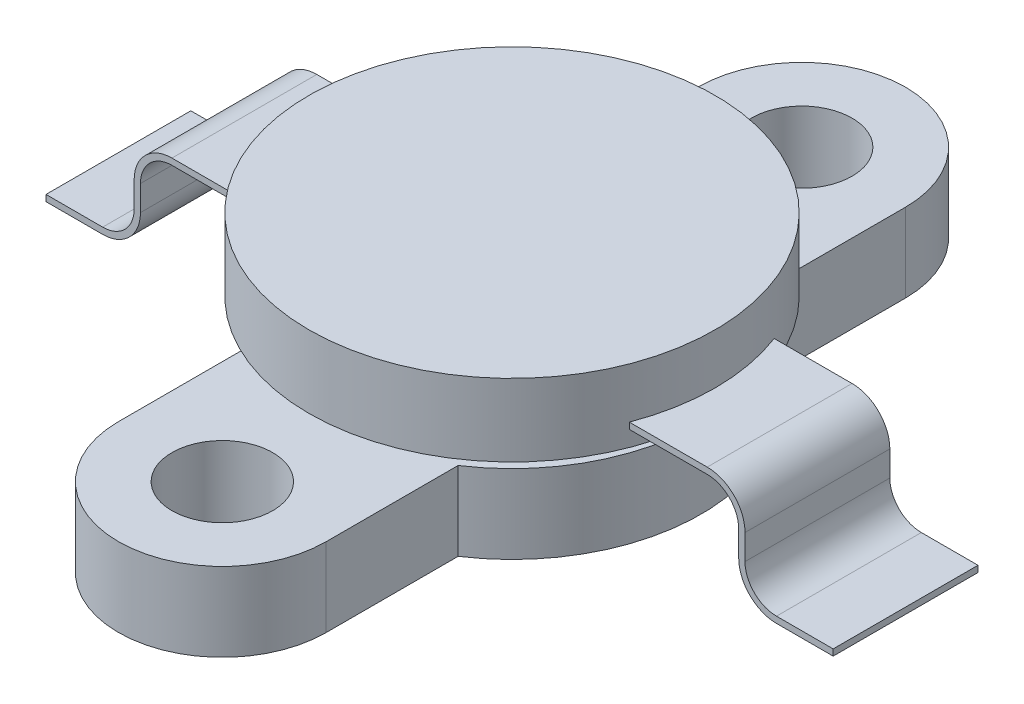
SolidWorks part; units mm, degrees
ref_plane "Front" through (0, 0, 0) normal (0, 0, 1) x (1, 0, 0)
ref_plane "Top" through (0, 0, 0) normal (0, 1, 0) x (1, 0, 0)
ref_plane "Right" through (0, 0, 0) normal (1, 0, 0) x (0, 0, -1)
sketch "Эскиз1" plane through (0, 0, 0) normal (0, 1, 0) x (1, 0, 0)
  line L0 (-3.3, 9.2) -> (-3.3, 5.011)
  line L1 (3.3, 9.2) -> (3.3, 5.011)
  line L2 (0, 0) -> (0, 9.2) construction
  line L3 (0, 0) -> (6, 0) construction
  line L4 (3.3, -9.2) -> (3.3, -5.011)
  line L5 (-3.3, -9.2) -> (-3.3, -5.011)
  arc A0 (-3.3, 5.011) -> (-3.3, -5.011) centre (0, 0) ccw
  arc A1 (3.3, 9.2) -> (-3.3, 9.2) centre (0, 9.2) ccw
  arc A2 (3.3, -9.2) -> (-3.3, -9.2) centre (0, -9.2) cw
  arc A3 (3.3, -5.011) -> (3.3, 5.011) centre (0, 0) ccw
  circle A4 centre (0, 9.2) radius 1.6
  circle A5 centre (0, -9.2) radius 1.6
  dimension "D1" = 6
  dimension "D2" = 18.4
  dimension "D4" = 3.2
  dimension "D3" = 6.6
extrude "Вытянуть1" add sketch "Эскиз1" along normal blind 2.5
sketch "Эскиз2" plane through (0, 2.5, 0) normal (0, 1, 0) x (-1, 0, 0)
  circle A0 centre (0, 0) radius 3.75
  dimension "D1" = 7.5
extrude "Вытянуть2" add sketch "Эскиз2" along normal blind 0.5
sketch "Эскиз3" plane through (0, 3, 0) normal (0, 1, 0) x (-1, 0, 0)
  circle A0 centre (0, 0) radius 6.45
  dimension "D1" = 12.9
extrude "Вытянуть3" add sketch "Эскиз3" along normal offset from surface (2.3 mm away) 5.3
sketch "Эскиз4" plane through (0, 0, 0) normal (0, 0, 1) x (1, 0, 0)
  line L0 (0, 0) -> (0, 5.3) construction
  line L1 (6.45, 5.3) -> (-6.45, 5.3) construction
  line L2 (12.5, 0.5) -> (10.7, 0.5)
  line L3 (9.5, 1.7) -> (9.5, 2.5)
  line L4 (8.5, 3.5) -> (-8.5, 3.5)
  line L5 (-9.5, 2.5) -> (-9.5, 1.7)
  line L6 (-10.7, 0.5) -> (-12.5, 0.5)
  line L7 (3.3, 0) -> (6, 0) construction
  arc A0 (9.5, 2.5) -> (8.5, 3.5) centre (8.5, 2.5) ccw
  arc A1 (-8.5, 3.5) -> (-9.5, 2.5) centre (-8.5, 2.5) ccw
  arc A2 (-9.5, 1.7) -> (-10.7, 0.5) centre (-10.7, 1.7) cw
  arc A3 (10.7, 0.5) -> (9.5, 1.7) centre (10.7, 1.7) cw
  dimension "D1" = 1
  dimension "D2" = 1.2
  dimension "D3" = 0.5
  dimension "D4" = 25
  dimension "D5" = 19
  dimension "D6" = 3
ref_plane "Плоскость1" through (12.5, 0, 0) normal (1, 0, 0) x (0, 0, -1)
sketch "Эскиз5" plane through (12.5, 0, 0) normal (1, 0, 0) x (0, 0, -1)
  line L1 (-2.3, 0.5) -> (2.3, 0.5)
  line L2 (-2.3, 0.5) -> (-2.3, 0.7)
  line L3 (-2.3, 0.7) -> (2.3, 0.7)
  line L4 (2.3, 0.5) -> (2.3, 0.7)
  dimension "D1" = 0.2
  dimension "D2" = 4.6
sweep "По траектории2" add profiles "Эскиз5" path "Эскиз4"
ref_plane "Плоскость2" through (0, 4, 0) normal (0, 1, 0) x (-1, 0, 0)
